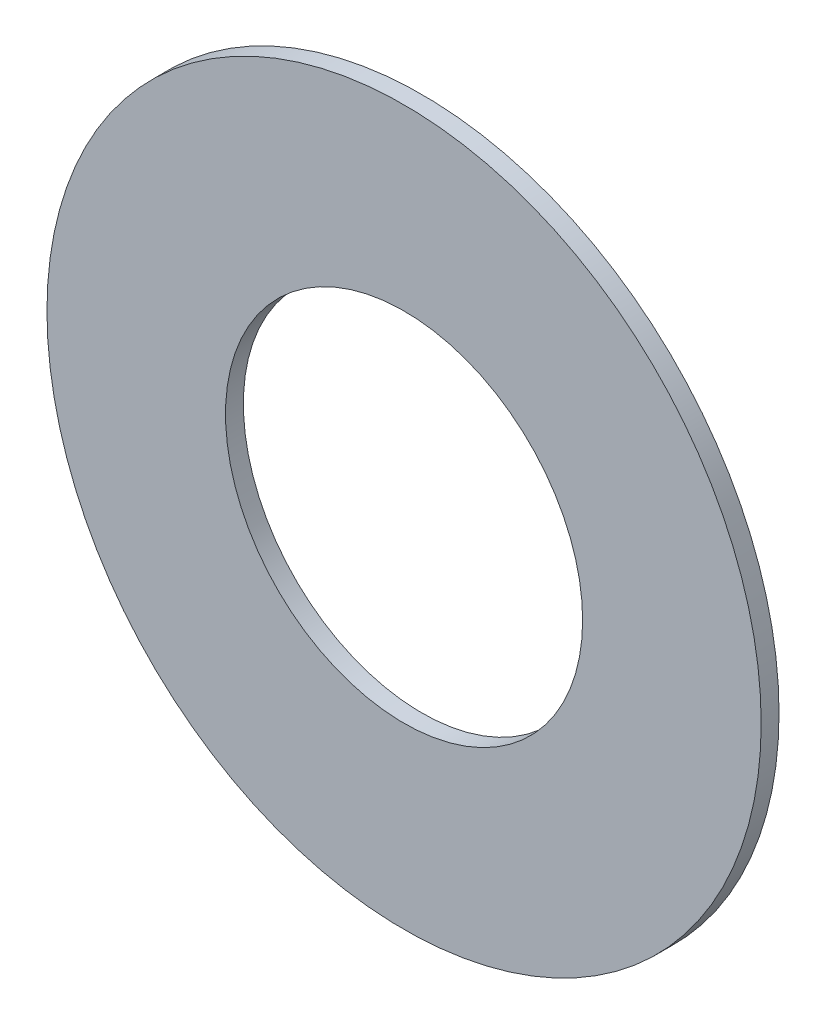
SolidWorks part; units mm, degrees
ref_plane "Face" through (0, 0, 0) normal (0, 0, 1) x (1, 0, 0)
ref_plane "Dessus" through (0, 0, 0) normal (0, 1, 0) x (1, 0, 0)
ref_plane "Droite" through (0, 0, 0) normal (1, 0, 0) x (0, 0, -1)
sketch "Esquisse1" plane through (0, 0, 0) normal (0, 0, 1) x (1, 0, 0)
  circle A0 centre (0, 0) radius 10
  circle A1 centre (0, 0) radius 5
  dimension "D1" = 20
  dimension "D2" = 10
extrude "Base-Extrusion" add sketch "Esquisse1" along normal mid plane 0.5
